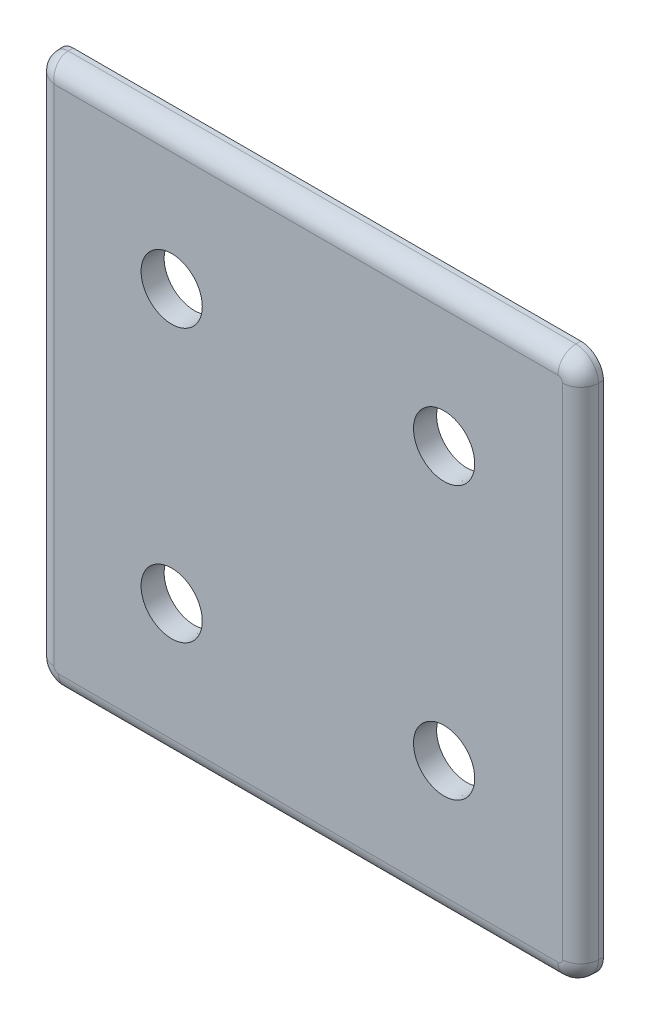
SolidWorks part; units mm, degrees
ref_plane "Front"
ref_plane "Top" through (0, 0, 0) normal (0, 1, 0) x (1, 0, 0)
ref_plane "Right" through (0, 0, 0) normal (1, 0, 0) x (0, 0, -1)
sketch "Sketch1" plane through (0, 0, 0) normal (0, 0, 1) x (1, 0, 0)
  line L1 (-38.1, -38.1) -> (38.1, -38.1)
  line L2 (-38.1, -38.1) -> (-38.1, 38.1)
  line L3 (-38.1, 38.1) -> (38.1, 38.1)
  line L4 (38.1, -38.1) -> (38.1, 38.1)
  dimension "D1" = 38.1
  dimension "D2" = 38.1
  dimension "D3" = 38.1
  dimension "D4" = 38.1
extrude "ENDCAP FORM" add sketch "Sketch1" along normal blind 3.175 draft 1
sketch "Sketch2" plane through (0, 0, 3.175) normal (0, 0, 1) x (1, 0, 0)
  line L0 (38.0446, 38.0446) -> (-38.0446, 38.0446) construction
  line L1 (38.0446, -38.0446) -> (38.0446, 38.0446) construction
  circle A0 centre (18.9946, 18.9946) radius 4.2799
  dimension "H1 DIA." = 8.5598
  dimension "H1 WIDTH" = 19.05
  dimension "H1 LENGTH" = 19.05
extrude "HOLE #1" cut sketch "Sketch2" against normal through all draft 1
sketch "Sketch3" plane through (0, 0, 3.175) normal (0, 0, 1) x (1, 0, 0)
  line L1 (38.0446, 38.0446) -> (-38.0446, 38.0446) construction
  circle A0 centre (-19.1054, 18.9946) radius 4.2799
  circle A2 centre (18.9946, 18.9946) radius 4.2799 construction
  dimension "H2 WIDTH" = 19.05
  dimension "H1-H2" = 38.1
extrude "HOLE #2" cut sketch "Sketch3" against normal through all draft 1
sketch "Sketch4" plane through (0, 0, 3.175) normal (0, 0, 1) x (1, 0, 0)
  line L0 (38.0446, -38.0446) -> (38.0446, 38.0446) construction
  circle A0 centre (18.9946, -19.1054) radius 4.2799
  circle A1 centre (18.9946, 18.9946) radius 4.2799 construction
  dimension "H4 LENGTH" = 19.05
  dimension "H1-H4" = 38.1
extrude "HOLE #4" cut sketch "Sketch4" against normal through all draft 1
sketch "Sketch5" plane through (0, 0, 3.175) normal (0, 0, 1) x (1, 0, 0)
  circle A0 centre (-19.1054, -19.1054) radius 4.2799
  circle A1 centre (-19.1054, 18.9946) radius 4.2799 construction
  circle A2 centre (18.9946, -19.1054) radius 4.2799 construction
  circle A3 centre (18.9946, 18.9946) radius 4.2799 construction
  dimension "H3-H4" = 38.1
  dimension "H2-H3" = 38.1
extrude "HOLE #3" cut sketch "Sketch5" against normal through all draft 1
fillet "CORNER FILLET" radius 3.175
fillet "Fillet3" [suppressed] radius 19.05
fillet "Fillet2" radius 2.54
sketch "Sketch7" plane through (0, 0, 0) normal (0, 0, -1) x (-1, 0, 0)
  line L0 (-36.195, 19.05) -> (-37.846, 19.05) construction
  line L1 (-37.846, 23.1394) -> (-36.195, 23.1394)
  line L2 (-37.846, 23.1394) -> (-37.846, 14.9606)
  line L3 (-37.846, 14.9606) -> (-36.195, 14.9606)
  line L4 (-36.195, 23.1394) -> (-36.195, 14.9606)
  line L5 (-34.9255, 38.1) -> (38.1, 38.1) construction
  line L6 (-38.1, -34.9255) -> (-38.1, 34.9255) construction
  dimension "LOCK TO SIDE" = 19.05
  dimension "LOCK LENGTH" = 8.1788
  dimension "LOCK WIDTH" = 1.651
  dimension "D4" = 0.254
extrude "Extrude1" [suppressed] add sketch "Sketch7" along normal blind 2.286 draft 1
fillet "Fillet4" radius 2.032
fillet "Fillet5" [suppressed] radius 2.032
fillet "Fillet6" [suppressed] radius 2.032
sketch "Sketch8" [suppressed] plane through (0, 0, 3.175) normal (0, 0, 1) x (1, 0, 0)
  line L0 (53.9636, -19.0381) -> (-53.9636, -19.0381) construction
  circle A0 centre (-38.1554, 0.0119) radius 4.1055
  circle A1 centre (-0.0554, -0.0554) radius 4.2799 construction
  dimension "HOLE 5" = 38.1
  dimension "HOLE TO HOLE" = 19.05
extrude "Cut-Extrude1" [suppressed] cut sketch "Sketch8" against normal through all draft 1
sketch "Sketch9" plane through (0, 0, 3.175) normal (0, 0, 1) x (1, 0, 0)
  line L0 (34.9136, -38.0881) -> (-34.9136, -38.0881) construction
  line L1 (-38.0881, -34.9136) -> (-38.0881, 36.0565) construction
  circle A0 centre (-25.3881, -25.3881) radius 10.16
  dimension "D1" = 12.7
  dimension "HOLE 5" = 20.32
  dimension "D2" = 12.7
extrude "Cut-Extrude2" [suppressed] cut sketch "Sketch9" against normal through all draft 1
sketch "Sketch12" [suppressed] plane through (0, 0, 3.175) normal (0, 0, 1) x (1, 0, 0)
  line L0 (-19.05, 0) -> (-19.05, 59.1096) construction
  line L1 (-19.05, 19.05) -> (66.8403, 19.05) construction
  line L2 (-19.05, -19.05) -> (65.1487, -19.05) construction
  line L3 (19.05, 19.05) -> (19.05, -11.0936) construction
  line L4 (-57.15, 19.05) -> (-57.15, -5.1728) construction
  line L5 (57.15, 19.05) -> (57.15, -5.1728) construction
  line L6 (0, 0) -> (-25.9788, 0) construction
  circle A0 centre (19.05, 19.05) radius 4.2799
  circle A1 centre (19.05, -19.05) radius 4.2799
  circle A2 centre (-57.15, 19.05) radius 4.2799
  circle A3 centre (-57.15, -19.05) radius 4.2799
  circle A4 centre (-19.05, 19.05) radius 4.2799
  circle A5 centre (-19.05, -19.05) radius 4.2799
  circle A6 centre (57.15, 19.05) radius 4.2799
  circle A7 centre (57.15, -19.05) radius 4.2799
  dimension "D1" = 8.5598
  dimension "D2" = 19.05
  dimension "D3" = 19.05
  dimension "D4" = 38.1
  dimension "D5" = 38.1
  dimension "D6" = 38.1
  dimension "D7" = 19.05
  dimension "D8" = 19.05
extrude "HOLE PATTERN #2" [suppressed] cut sketch "Sketch12" against normal through all
sketch "Sketch13" [suppressed] plane through (0, 0, 3.175) normal (0, 0, 1) x (1, 0, 0)
  circle A0 centre (19.9898, 19.9898) radius 4.2799
  circle A1 centre (19.9898, -19.9898) radius 4.2799
  circle A2 centre (-19.9898, -19.9898) radius 4.2799
  circle A3 centre (-19.9898, 19.9898) radius 4.2799
  point P0 (-19.9898, 19.9898)
  point P1 (-19.9898, -19.9898)
  point P2 (19.9898, -19.9898)
  point P3 (19.9898, 19.9898)
  dimension "D9" = 8.5598
  dimension "D10" = 8.5598
  dimension "D11" = 8.5598
  dimension "D12" = 8.5598
  dimension "D1" = 19.9898
  dimension "D2" = 19.9898
  dimension "D3" = 19.9898
  dimension "D4" = 19.9898
  dimension "D5" = 19.9898
  dimension "D6" = 19.9898
  dimension "D7" = 19.9898
  dimension "D8" = 19.9898
extrude "Cut-Extrude3" [suppressed] cut sketch "Sketch13" against normal through all
